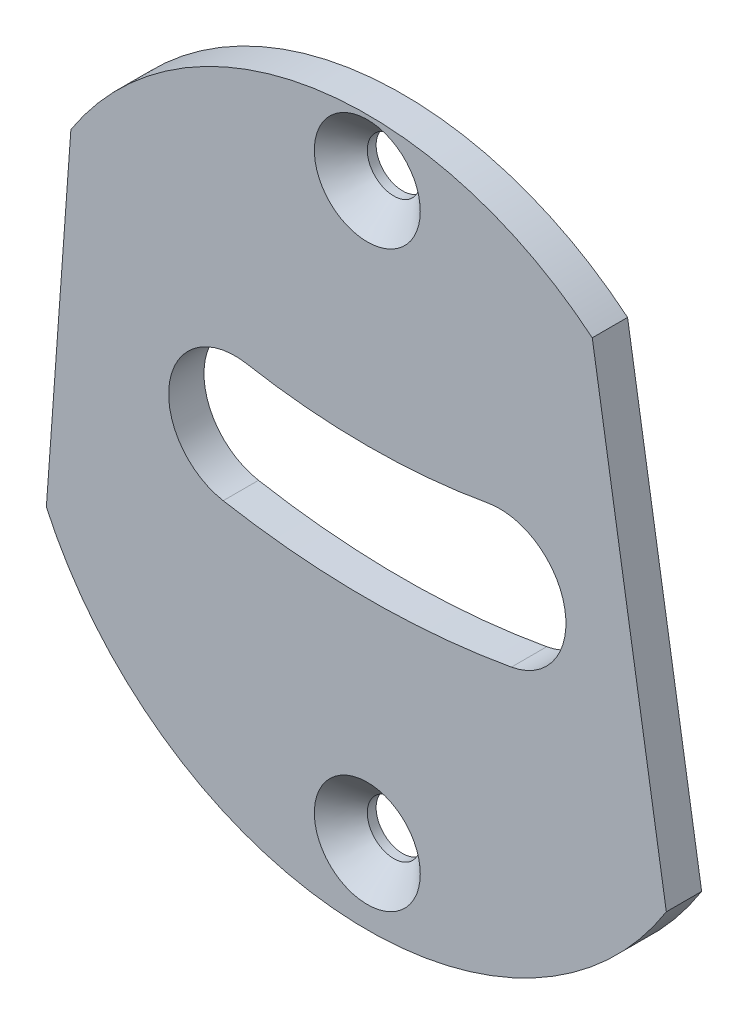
SolidWorks part; units mm, degrees
ref_plane "Face" through (0, 0, 0) normal (0, 0, 1) x (1, 0, 0)
ref_plane "Dessus" through (0, 0, 0) normal (0, 1, 0) x (1, 0, 0)
ref_plane "Droite" through (0, 0, 0) normal (1, 0, 0) x (0, 0, -1)
sketch "Esquisse1" plane through (0, 0, 0) normal (0, 0, 1) x (1, 0, 0)
  line L0 (-9, 13.5) -> (11, 13.5) construction
  line L1 (-9, -51.5) -> (11, -51.5) construction
  line L4 (-32.5751, 1.7419) -> (-35.3543, -36.6843)
  line L5 (1, 65) -> (-16.664, -33.525) construction
  line L6 (1, 65) -> (18.6231, -33.2971) construction
  line L7 (26.4805, 10.8341) -> (34.8717, -41.277)
  line L8 (21, 44.8697) -> (21.0364, 44.6434)
  circle A0 centre (1, 13.5) radius 3
  circle A1 centre (1, -51.5) radius 3
  arc A2 (26.4805, 10.8341) -> (-32.5751, 1.7419) centre (1, -20) ccw
  arc A3 (-14, -18.666) -> (16, -18.666) centre (1, 65) ccw construction
  arc A4 (-12.6765, -11.2837) -> (14.6765, -11.2837) centre (1, 65) ccw
  arc A5 (-15.3235, -26.0483) -> (17.3235, -26.0483) centre (1, 65) ccw
  arc A6 (17.3235, -26.0483) -> (14.6765, -11.2837) centre (16, -18.666) ccw
  arc A7 (-12.6765, -11.2837) -> (-15.3235, -26.0483) centre (-14, -18.666) ccw
  arc A9 (-35.3543, -36.6843) -> (34.8717, -41.277) centre (1, -20) ccw
  dimension "D1" = 6
  dimension "D2" = 15
  dimension "D3" = 80
  dimension "D4" = 6
extrude "Extrusion1" add sketch "Esquisse1" along normal blind 4
chamfer "Chanfrein3" distance 3 angle 45 2 edges at (4, -51.5, 4) (4, 13.5, 4)
